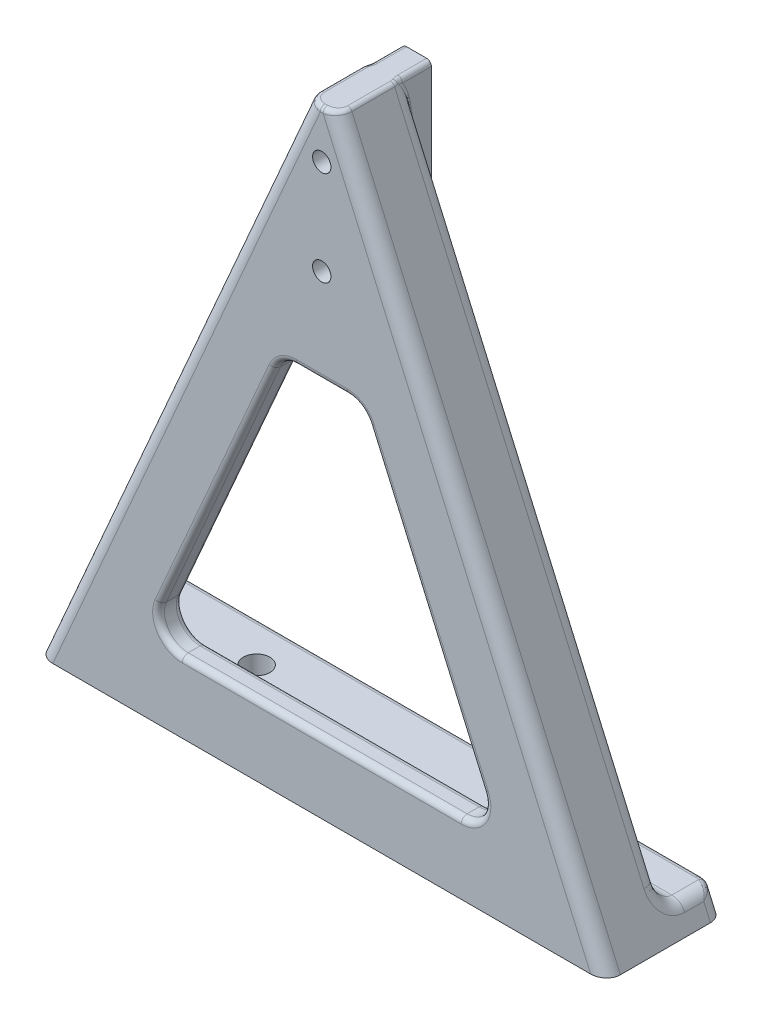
SolidWorks part; units mm, degrees
ref_plane "Front Plane" through (0, 0, 0) normal (0, 0, 1) x (1, 0, 0)
ref_plane "Top Plane" through (0, 0, 0) normal (0, 1, 0) x (1, 0, 0)
ref_plane "Right Plane" through (0, 0, 0) normal (1, 0, 0) x (0, 0, -1)
sketch "Sketch1" plane through (0, 0, 0) normal (0, 0, 1) x (1, 0, 0)
  line L0 (0, 0) -> (0, 56.035) construction
  line L1 (3.9688, 165.1) -> (-3.9688, 165.1)
  line L2 (-3.9688, 165.1) -> (-76.2, 0)
  line L3 (-76.2, 0) -> (76.2, 0)
  line L4 (3.9688, 165.1) -> (76.2, 0)
  point P8 (0, 165.1)
  dimension "D1" = 7.9375
  dimension "D2" = 165.1
  dimension "D3" = 152.4
extrude "Boss-Extrude1" add sketch "Sketch1" along normal blind 6.35
sketch "Sketch2" plane through (0, 165.1, 0) normal (0, 1, 0) x (1, 0, 0)
  line L0 (3.9688, -6.35) -> (3.9688, 0) construction
  line L1 (-3.9688, 0) -> (3.9688, 0)
  line L2 (-3.9688, 0) -> (-3.9688, 19.05)
  line L3 (-3.9688, 19.05) -> (3.9688, 19.05)
  line L4 (3.9688, 0) -> (3.9688, 19.05)
  dimension "D1" = 19.05
extrude "Boss-Extrude2" add sketch "Sketch2" against normal blind 50.8
hole_wizard "#10 (0.1935) Diameter Hole1" positions "Sketch5" profile "Sketch6" hole size "#10" standard "ANSI Inch"
sketch "Sketch5" plane through (0, 0, -19.05) normal (0, 0, -1) x (-1, 0, 0)
  line L0 (76.2, 0) -> (-76.2, 0) construction
  point P0 (0, 152.4)
  point P2 (0, 127)
  point P5 (0, 0)
  dimension "D1" = 152.4
  dimension "D2" = 25.4
sketch "Sketch6" plane through (0, 152.4, -19.05) normal (1, 0, 0) x (0, 1, 0)
  line L0 (0, 0) -> (0, 25.4)
  line L1 (0, 25.4) -> (2.4574, 25.4)
  line L2 (2.4574, 25.4) -> (2.4574, 0)
  line L5 (2.4574, 0) -> (0, 0)
  line L11 (0, -6.35) -> (0, 107.95) construction
  dimension "Thru Hole Dia." = 4.9149
  dimension "Thru Hole Depth" = 25.4
sketch "Sketch7" plane through (0, 0, 0) normal (0, 0, -1) x (-1, 0, 0)
  line L0 (-76.2, 0) -> (76.2, 0)
  line L1 (76.2, 0) -> (73.4219, 6.35)
  line L2 (3.9688, 165.1) -> (76.2, 0) construction
  line L3 (73.4219, 6.35) -> (-73.4219, 6.35)
  line L4 (-76.2, 0) -> (-3.9688, 165.1) construction
  line L5 (-73.4219, 6.35) -> (-76.2, 0)
  dimension "D1" = 6.35
extrude "Boss-Extrude3" add sketch "Sketch7" along normal blind 25.4
sketch "Sketch8" plane through (0, 0, 0) normal (0, 0, -1) x (-1, 0, 0)
  line L0 (-3.9688, 165.1) -> (-73.4219, 6.35)
  line L1 (-73.4219, 6.35) -> (-66.4908, 6.35)
  line L2 (73.4219, 6.35) -> (-73.4219, 6.35) construction
  line L3 (-66.4908, 6.35) -> (-3.9687, 149.2574)
  line L4 (-3.9688, 114.3) -> (-3.9688, 165.1) construction
  line L5 (-3.9687, 149.2574) -> (-3.9688, 165.1)
  dimension "D1" = 6.35
extrude "Boss-Extrude4" add sketch "Sketch8" along normal blind 12.7
mirror "Mirror1" about plane through (0, 0, 0) normal (1, 0, 0) of "Boss-Extrude4"
fillet "Fillet1" radius 3.81 6 edges at (35.2298, 77.8037, 0) (3.9688, 131.7787, 0) (0, 114.3, 0) (-3.9688, 131.7787, 0) (-35.2298, 77.8037, 0) (0, 6.35, 0)
fillet "Fillet2" radius 3.81 18 edges at (-64.7845, 7.4659, -1.1159) (64.7845, 7.4659, -1.1159) (-66.4908, 6.35, -8.255) (-69.9563, 6.35, -12.7) (69.9563, 6.35, -12.7) (66.4908, 6.35, -8.255) (38.6953, 85.725, -12.7) (-38.6953, 85.725, -12.7) (73.4219, 6.35, -19.05) (-73.4219, 6.35, -19.05) (-74.8109, 3.175, -25.4) (74.8109, 3.175, -25.4) (-5.0847, 143.9226, -1.1159) (5.0847, 143.9226, -1.1159) (-3.9687, 149.2574, -8.255) (3.9688, 149.2574, -8.255) (40.0844, 82.55, 6.35) (-40.0844, 82.55, 6.35)
sketch "Sketch9" plane through (0, 0, 0) normal (0, 0, -1) x (-1, 0, 0)
  line L12 (-10.9566, 101.6) -> (-47.0723, 19.05)
  line L13 (-47.0723, 19.05) -> (47.0723, 19.05)
  line L14 (47.0723, 19.05) -> (10.9566, 101.6)
  line L15 (10.9566, 101.6) -> (-10.9566, 101.6)
  line L16 (-12.6212, 97.7952) -> (-43.1806, 27.9452)
  line L17 (-37.363, 19.05) -> (37.363, 19.05)
  line L18 (43.1806, 27.9452) -> (12.6212, 97.7952)
  line L19 (6.8036, 101.6) -> (-6.8036, 101.6)
  arc A0 (-43.1806, 27.9452) -> (-37.363, 19.05) centre (-37.363, 25.4) ccw
  arc A1 (37.363, 19.05) -> (43.1806, 27.9452) centre (37.363, 25.4) ccw
  arc A2 (12.6212, 97.7952) -> (6.8036, 101.6) centre (6.8036, 95.25) ccw
  arc A3 (-12.6212, 97.7952) -> (-6.8036, 101.6) centre (-6.8036, 95.25) cw
  dimension "D2" = 6.35
  dimension "D1" = 8.89
extrude "Cut-Extrude2" cut sketch "Sketch9" against normal through all
fillet "Fillet3" radius 1.5875 21 edges at (42.6773, 21.9243, 6.35) (27.9009, 62.8702, 6.35) (10.2793, 100.5643, 6.35) (0, 101.6, 6.35) (-10.2793, 100.5643, 6.35) (-27.9009, 62.8702, 6.35) (-42.6773, 21.9243, 6.35) (42.6773, 21.9243, 0) (27.9009, 62.8702, 0) (10.2793, 100.5643, 0) (0, 101.6, 0) (-10.2793, 100.5643, 0) (-27.9009, 62.8702, 0) (-42.6773, 21.9243, 0) (0, 19.05, 6.35) (0, 19.05, 0) (-73.0155, 5.7286, -23.6754) (-70.1147, 6.35, -25.3193) (73.0155, 5.7286, -23.6754) (70.1147, 6.35, -25.3193) (0, 6.35, -25.4)
fillet "Fillet5" radius 1.27 14 edges at (2.8171, 165.1, 5.1718) (3.9688, 165.1, -3.175) (3.9688, 162.3159, -11.5841) (-3.9687, 143.3189, -12.7) (-2.8171, 165.1, 5.1718) (-3.9688, 165.1, -13.97) (3.9688, 165.1, -13.97) (3.9687, 143.3189, -12.7) (-3.9688, 162.3159, -11.5841) (-3.9688, 165.1, -3.175) (5.0847, 113.1841, -1.1159) (-5.0847, 113.1841, -1.1159) (3.9688, 114.3, -11.43) (-3.9688, 114.3, -11.43)
hole_wizard "9/32 (0.28125) Diameter Hole1" positions "Sketch10" profile "Sketch11" hole size "9/32" standard "ANSI Inch"
sketch "Sketch10" plane through (0, 6.35, 0) normal (0, 1, 0) x (1, 0, 0)
  line L0 (0, 0) -> (0, 55.8031) construction
  line L1 (69.9577, 23.8125) -> (-69.9577, 23.8125) construction
  point P0 (38.1, 14.2875)
  point P2 (-38.1, 14.2875)
  point P10 (0, 0)
  point P11 (0, 0)
  dimension "D1" = 76.2
  dimension "D2" = 9.525
sketch "Sketch11" plane through (38.1, 6.35, -14.2875) normal (1, 0, 0) x (0, 0, 1)
  line L0 (0, 0) -> (0, 6.35)
  line L1 (0, 6.35) -> (3.5719, 6.35)
  line L2 (3.5719, 6.35) -> (3.5719, 0)
  line L5 (3.5719, 0) -> (0, 0)
  line L11 (0, -6.35) -> (0, 107.95) construction
  dimension "Thru Hole Dia." = 7.1437
  dimension "Thru Hole Depth" = 6.35
